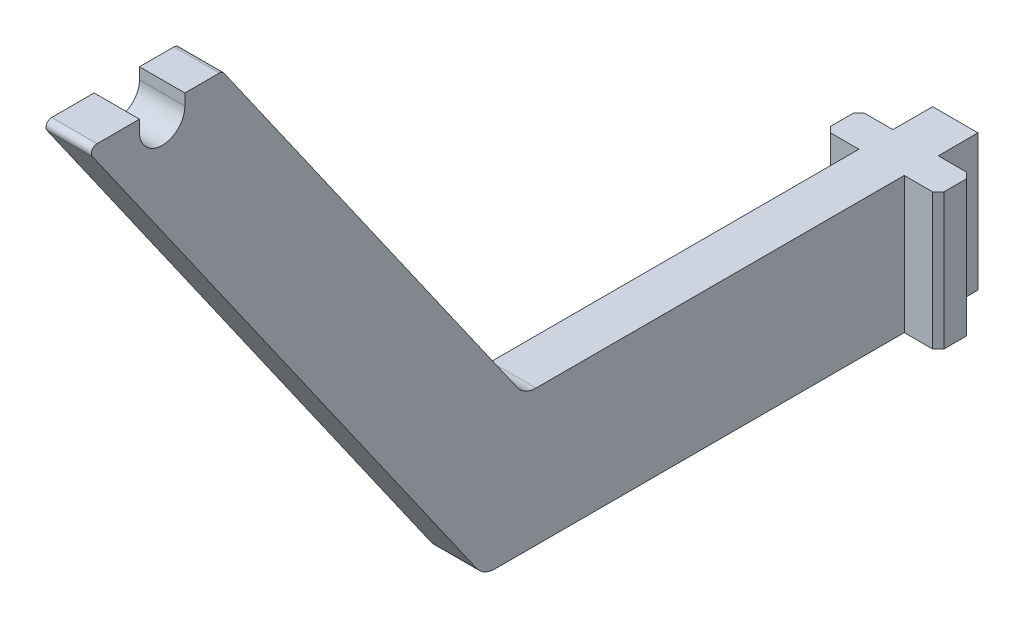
SolidWorks part; units mm, degrees
ref_plane "前视基准面" through (0, 0, 0) normal (0, 0, 1) x (1, 0, 0)
ref_plane "上视基准面" through (0, 0, 0) normal (0, 1, 0) x (1, 0, 0)
ref_plane "右视基准面" through (0, 0, 0) normal (1, 0, 0) x (0, 0, -1)
sketch "草图1" plane through (0, 0, 0) normal (1, 0, 0) x (0, 0, -1)
  line L0 (0, 0) -> (0, 6)
  line L1 (0, 6) -> (-20, 6)
  line L2 (-20, 6) -> (-33.3039, 25)
  line L3 (0, 0) -> (-21.7988, 0)
  line L4 (-21.7988, 0) -> (-39.3039, 25)
  line L5 (-39.3039, 25) -> (-33.3039, 25)
  dimension "D1" = 125
  dimension "D2" = 6
  dimension "D3" = 25
  dimension "D4" = 20
  dimension "D5" = 6
extrude "凸台-拉伸1" add sketch "草图1" along normal mid plane 2
sketch "草图2" plane through (0, 6, 0) normal (0, 1, 0) x (1, 0, 0)
  line L0 (-9.6073, -2.5) -> (8.8025, -2.5) construction
  line L1 (-1, -1.75) -> (-2.5, -1.75)
  line L2 (-1, 0) -> (-1, -20) construction
  line L3 (-2.5, -1.75) -> (-2.5, -3.25)
  line L4 (-2.5, -3.25) -> (-1, -3.25)
  line L5 (-1, -3.25) -> (-1, -1.75)
  line L6 (0, 3.2996) -> (0, -7.6258) construction
  line L7 (1, -3.25) -> (1, -1.75)
  line L8 (2.5, -3.25) -> (1, -3.25)
  line L9 (2.5, -1.75) -> (2.5, -3.25)
  line L10 (1, -1.75) -> (2.5, -1.75)
  dimension "D1" = 2.5
  dimension "D2" = 1.5
  dimension "D3" = 1.5
extrude "凸台-拉伸2" add sketch "草图2" against normal up to surface (6 mm away)
sketch "草图3" plane through (-1, 0, 0) normal (-1, 0, 0) x (0, 0, 1)
  line L1 (28.188, 13.4093) -> (25.2233, 9.1752) construction
  line L2 (20, 6) -> (33.3039, 25) construction
  line L3 (33.3039, 25) -> (39.3039, 25) construction
  line L4 (19.1527, 24.5) -> (22.4741, 24.5) construction
  line L5 (34.9538, 24.5) -> (34.9538, 25)
  line L6 (34.9538, 25) -> (36.9538, 25)
  line L7 (36.9538, 25) -> (36.9538, 24.5)
  arc A0 (34.9538, 24.5) -> (36.9538, 24.5) centre (35.9538, 24.5) ccw
  point P6 (36.3039, 25)
  dimension "D1" = 2
  dimension "D2" = 0.5
extrude "切除-拉伸1" cut sketch "草图3" against normal through all
fillet "圆角1" radius 1 2 edges at (0, 6, 20) (0, 0, 21.7988)
fillet "圆角2" radius 0.25 2 edges at (0, 25, 39.3039) (0, 25, 33.3039)
chamfer "倒角1" distance 0.25 angle 45 4 edges at (-2.5, 3, 3.25) (-2.5, 3, 1.75) (2.5, 3, 3.25) (2.5, 3, 1.75)
